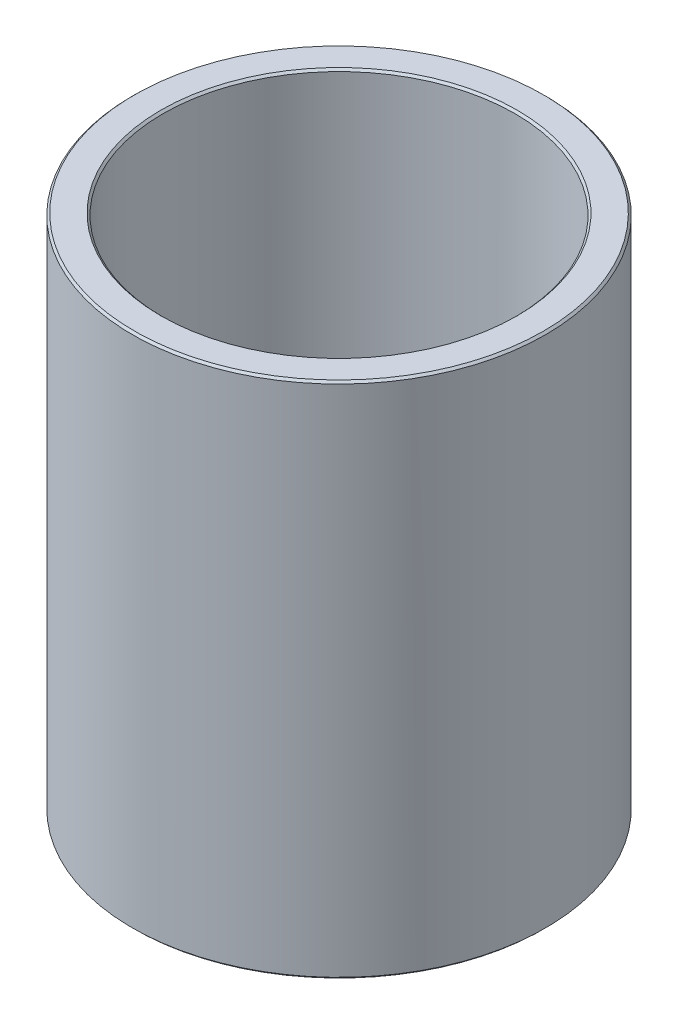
SolidWorks part; units mm, degrees
ref_plane "Plan1" through (0, 0, 0) normal (0, 0, 1) x (1, 0, 0)
ref_plane "Plan2" through (0, 0, 0) normal (0, 1, 0) x (1, 0, 0)
ref_plane "Plan3" through (0, 0, 0) normal (1, 0, 0) x (0, 0, -1)
sketch "Esquisse1" plane through (0, 0, 0) normal (0, 0, 1) x (1, 0, 0)
  line L0 (0, 66.5926) -> (0, -31.8454) construction
  line L1 (0, -50) -> (0, 50) construction
  line L2 (17, 50) -> (19.95, 50)
  line L3 (17, 50) -> (17, 0)
  line L4 (17, 0) -> (19.95, 0)
  line L5 (19.95, 50) -> (19.95, 0)
  line L6 (50, 0) -> (-50, 0) construction
  dimension "D1" = 50
  dimension "D2" = 34
  dimension "D3" = 39.9
revolve "Révolution1" add sketch "Esquisse1" angle 360 about L0
chamfer "Chanfrein1" distance 0.2 angle 45 4 edges at (-17, 50, 0) (-17, 0, 0) (-19.95, 0, 0) (-19.95, 50, 0)
